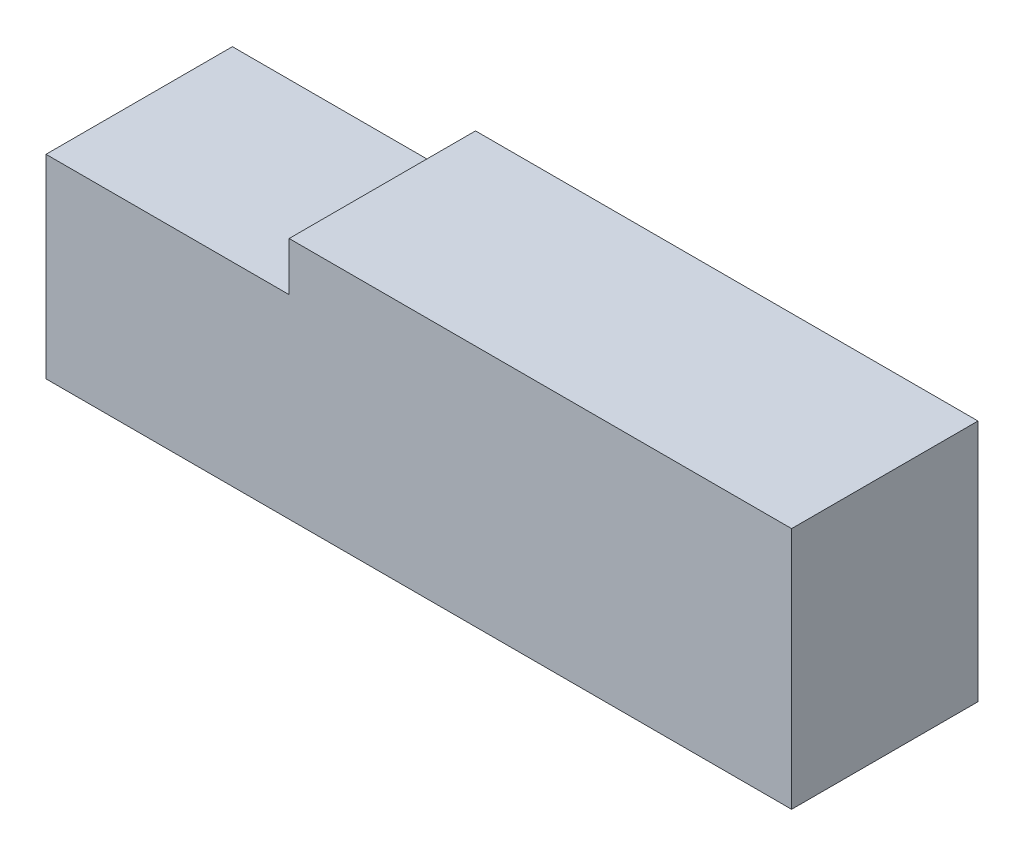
SolidWorks part; units mm, degrees
ref_plane "Front Plane" through (0, 0, 0) normal (0, 0, 1) x (1, 0, 0)
ref_plane "Top Plane" through (0, 0, 0) normal (0, 1, 0) x (1, 0, 0)
ref_plane "Right Plane" through (0, 0, 0) normal (1, 0, 0) x (0, 0, -1)
sketch "Sketch1" plane through (0, 0, 0) normal (0, 1, 0) x (1, 0, 0)
  line L1 (-115, 28.75) -> (115, 28.75)
  line L2 (-115, 28.75) -> (-115, -28.75)
  line L3 (-115, -28.75) -> (115, -28.75)
  line L4 (115, 28.75) -> (115, -28.75)
  line L5 (-115, 28.75) -> (115, -28.75) construction
  line L6 (-115, -28.75) -> (115, 28.75) construction
  point P0 (0, 0)
  dimension "D1" = 230
  dimension "D2" = 57.5
extrude "Boss-Extrude1" add sketch "Sketch1" along normal mid plane 75
sketch "Sketch2" plane through (0, 37.5, 0) normal (0, 1, 0) x (1, 0, 0)
  line L2 (-115, -28.75) -> (115, -28.75) construction
  line L5 (-115, 28.75) -> (-40, 28.75)
  line L6 (-115, 28.75) -> (-115, -28.75)
  line L7 (-115, -28.75) -> (-40, -28.75)
  line L8 (-40, 28.75) -> (-40, -28.75)
  dimension "D1" = 75
extrude "Cut-Extrude1" cut sketch "Sketch2" against normal blind 15
